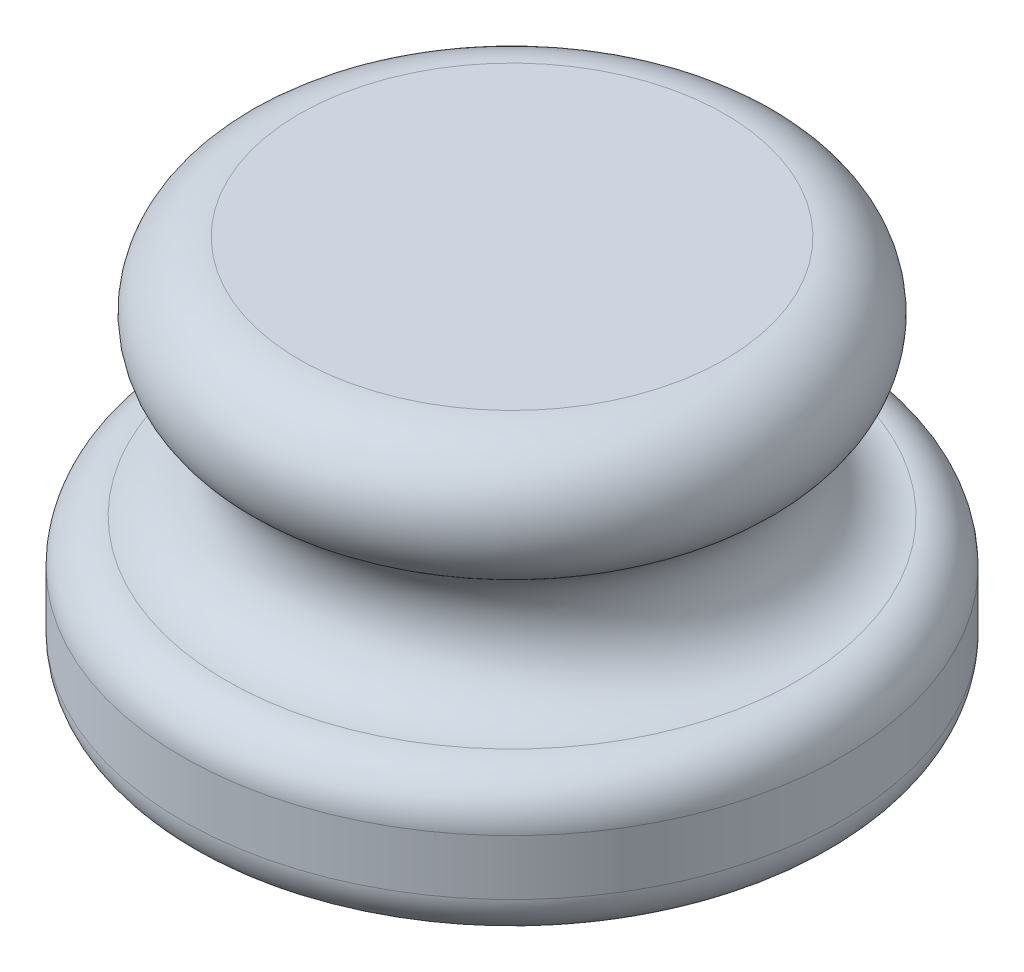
SolidWorks part; units mm, degrees
ref_plane "Front Plane" through (0, 0, 0) normal (0, 0, 1) x (1, 0, 0)
ref_plane "Top Plane" through (0, 0, 0) normal (0, 1, 0) x (1, 0, 0)
ref_plane "Right Plane" through (0, 0, 0) normal (1, 0, 0) x (0, 0, -1)
sketch "Sketch1" plane through (0, 0, 0) normal (0, 0, 1) x (1, 0, 0)
  line L0 (0, 0) -> (-13, 0)
  line L1 (-15, 2) -> (-15, 4.52)
  line L2 (-9.6834, 17.52) -> (0, 17.52)
  line L3 (0, 17.52) -> (0, 0)
  arc A0 (-13, 0) -> (-15, 2) centre (-13, 2) cw
  arc A1 (-15, 4.52) -> (-13, 6.52) centre (-13, 4.52) cw
  arc A2 (-13, 6.52) -> (-11.3417, 12.02) centre (-13, 9.52) ccw
  arc A3 (-11.3417, 12.02) -> (-9.6834, 17.52) centre (-9.6834, 14.52) cw
  dimension "D1" = 15
  dimension "D3" = 2
  dimension "D4" = 2
  dimension "D5" = 3
  dimension "D6" = 3
  dimension "D2" = 13
  dimension "D7" = 17.52
revolve "Revolve1" add sketch "Sketch1" angle 360 about L3
